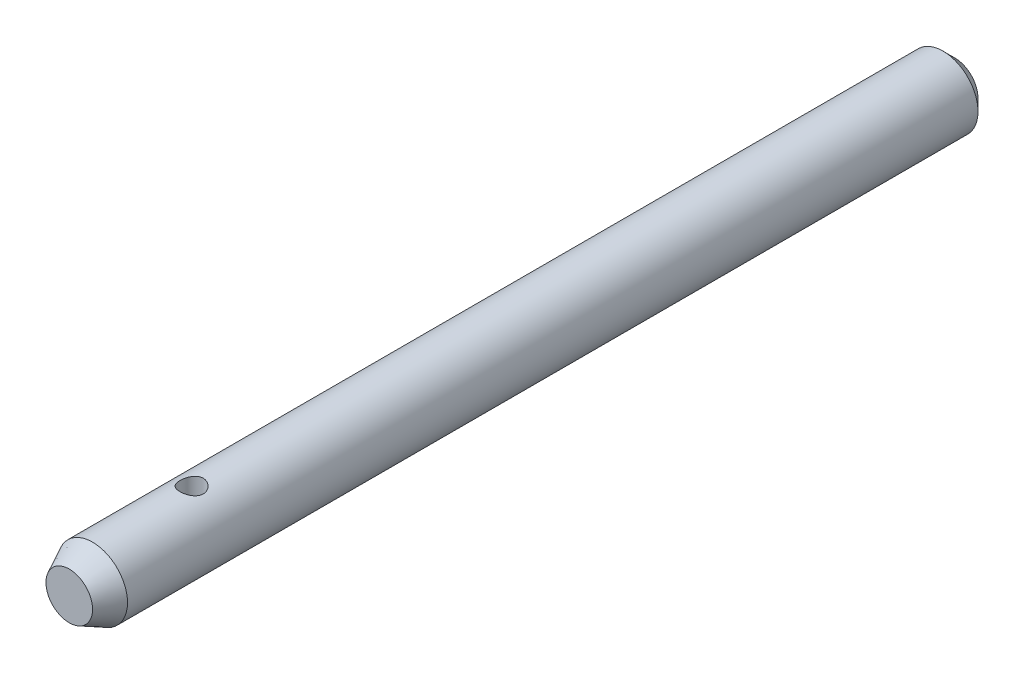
SolidWorks part; units mm, degrees
ref_plane "Face" through (0, 0, 0) normal (0, 0, 1) x (1, 0, 0)
ref_plane "Dessus" through (0, 0, 0) normal (0, 1, 0) x (1, 0, 0)
ref_plane "Droite" through (0, 0, 0) normal (1, 0, 0) x (0, 0, -1)
sketch "Esquisse1" plane through (0, 0, 0) normal (0, 0, 1) x (1, 0, 0)
  circle A0 centre (0, 0) radius 3
  dimension "D1" = 6
extrude "Base-Extrusion" add sketch "Esquisse1" along normal blind 76
chamfer "Chanfrein1" distance 2 distance2 1 1 edges at (3, 0, 76)
chamfer "Chanfrein2" distance 1 angle 45 1 edges at (3, 0, 0)
sketch "Esquisse2" plane through (0, 0, 0) normal (0, 1, 0) x (1, 0, 0)
  line L0 (0, -74) -> (0, -1) construction
  line L1 (-2, -76) -> (2, -76) construction
  circle A0 centre (0, -65.5) radius 1
  dimension "D2" = 2
  dimension "D1" = 10.5
extrude "Enlèv. mat.-Extru.1" cut sketch "Esquisse2" against normal mid plane 10
